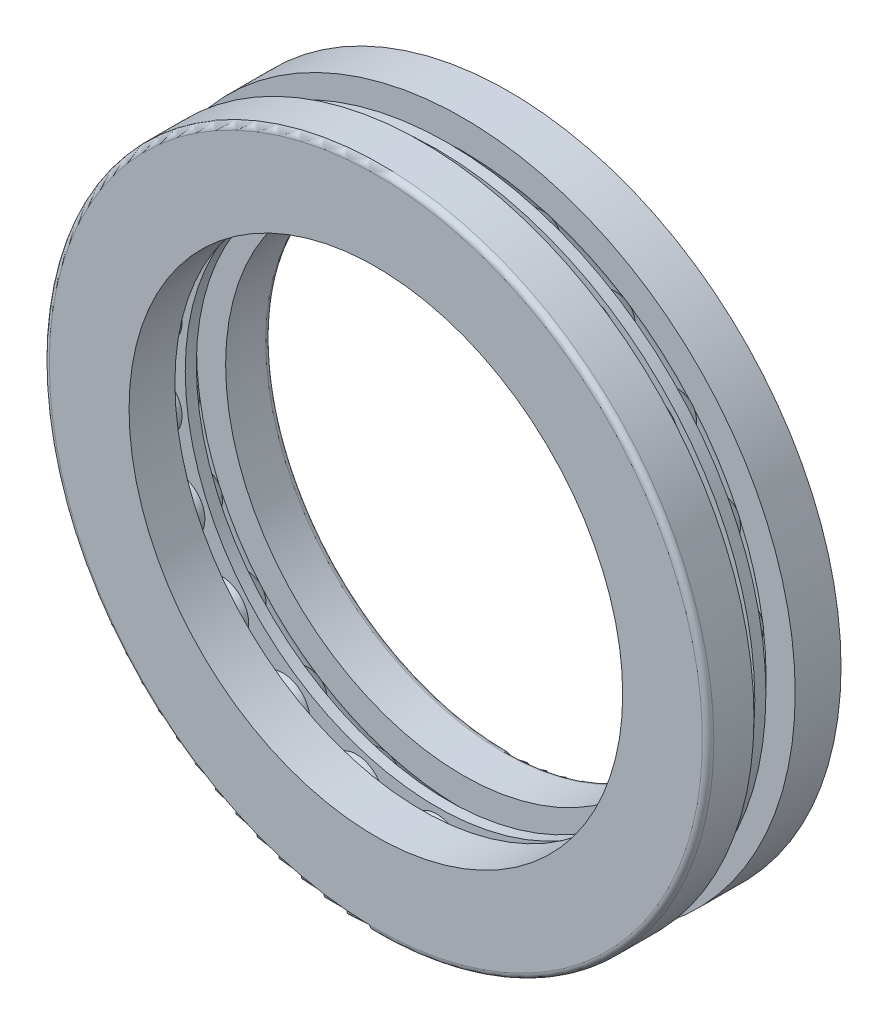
SolidWorks part; units mm, degrees
ref_plane "Front Plane" through (0, 0, 0) normal (0, 0, 1) x (1, 0, 0)
ref_plane "Top Plane" through (0, 0, 0) normal (0, 1, 0) x (1, 0, 0)
ref_plane "Right Plane" through (0, 0, 0) normal (1, 0, 0) x (0, 0, -1)
sketch "BaseSke" plane through (0, 0, 0) normal (1, 0, 0) x (0, 0, -1)
  line L0 (-22.7078, 0) -> (24.6132, 0) construction
  line L1 (-22.7078, 30) -> (24.6132, 30) construction
  line L2 (0, 129.5214) -> (0, -86.3012) construction
  line L3 (0, 32.9167) -> (0, 27.0833)
  line L6 (-7, 35) -> (-7, 26) construction
  line L8 (7, 35) -> (7, 25) construction
  arc A0 (0, 32.9167) -> (0, 27.0833) centre (0, 30) ccw
revolve "Ball" add sketch "BaseSke" angle 360 about L3
sketch "InnerRaceSke" plane through (0, 0, 0) normal (1, 0, 0) x (0, 0, -1)
  line L0 (2.1724, 28.0689) -> (2.1724, 25)
  line L1 (2.1724, 35) -> (7, 35)
  line L2 (2.1724, 35) -> (2.1724, 31.9311)
  line L3 (2.1724, 25) -> (7, 25)
  line L4 (7, 35) -> (7, 25)
  line L5 (-18.959, 0) -> (19.5136, 0) construction
  arc A0 (2.1724, 28.0689) -> (2.1724, 31.9311) centre (0, 30) ccw
  arc A2 (0, 32.9167) -> (0, 27.0833) centre (0, 30) ccw construction
revolve "InnerRace" add sketch "InnerRaceSke" angle 360 about L5
sketch "OuterRaceSke" plane through (0, 0, 0) normal (1, 0, 0) x (0, 0, -1)
  line L0 (-2.1724, 28.0689) -> (-2.1724, 26)
  line L1 (-7, 35) -> (-2.1724, 35)
  line L2 (-7, 35) -> (-7, 26)
  line L3 (-7, 26) -> (-2.1724, 26)
  line L4 (-2.1724, 35) -> (-2.1724, 31.9311)
  line L5 (-27.1643, 0) -> (37.3715, 0) construction
  arc A0 (-2.1724, 31.9311) -> (-2.1724, 28.0689) centre (0, 30) ccw
  arc A1 (0, 32.9167) -> (0, 27.0833) centre (0, 30) ccw construction
revolve "OuterRace" add sketch "OuterRaceSke" angle 360 about L5
fillet "Fillet1" radius 0.6 2 edges at (35, 0, 7) (25, 0, -7)
pattern_circular "CirPatternBall" count 22 over 360 about axis through (0, 0, 0) along (0, 0, 1) of "Ball"
sketch "CageSke" plane through (0, 0, 0) normal (1, 0, 0) x (0, 0, -1)
  line L0 (0, 59.1614) -> (0, 0) construction
  line L1 (0.5833, 33.5) -> (-0.5833, 33.5)
  line L2 (0.5833, 33.5) -> (0.5833, 26.5)
  line L3 (0.5833, 26.5) -> (-0.5833, 26.5)
  line L4 (-0.5833, 33.5) -> (-0.5833, 26.5)
  line L5 (-23.077, 0) -> (28.998, 0) construction
  circle A0 centre (0, 30) radius 3.5483 construction
  arc A1 (0, 32.9167) -> (0, 27.0833) centre (0, 30) ccw construction
revolve "Cage" add sketch "CageSke" angle 360 about L5
sketch "SimplifiedSke" plane through (0, 0, 0) normal (1, 0, 0) x (0, 0, -1)
  line L0 (-32.3536, 0) -> (41.9236, 0) construction
  circle A0 centre (0, 30) radius 2.9167
  arc A1 (0, 32.9167) -> (0, 27.0833) centre (0, 30) ccw construction
revolve "Simplified" [suppressed] add sketch "SimplifiedSke" angle 360 about L0
equation "\"D2@BaseSke\" = \"Bearing_Thickness@BaseSke\"/2"
equation "\"D1@BaseSke\" =  ( \"Diameter2@BaseSke\" + \"Bearing_Inside_Diameter@BaseSke\" )  / 4"
equation "\"Ball_diameter@BaseSke\" = \"Bearing_Thickness@BaseSke\"  / 2.4"
equation "\"D1@InnerRaceSke\" = \"Ball_diameter@BaseSke\"-0.02"
equation "\"D2@InnerRaceSke\" = \"Bearing_Thickness@BaseSke\"/2.9"
equation "\"D1@OuterRaceSke\" = \"Ball_diameter@BaseSke\"-0.02"
equation "\"D2@OuterRaceSke\" = \"Bearing_Thickness@BaseSke\" / 2.9"
equation "\"D1@CirPatternBall\" =  pi  * \"D1@BaseSke\" * 2 / \"Ball_diameter@BaseSke\"/1.5"
equation "\"D1@CageSke\" = \"Ball_diameter@BaseSke\"/5"
equation "\"D2@CageSke\" = \"Ball_diameter@BaseSke\" * 1.2"
